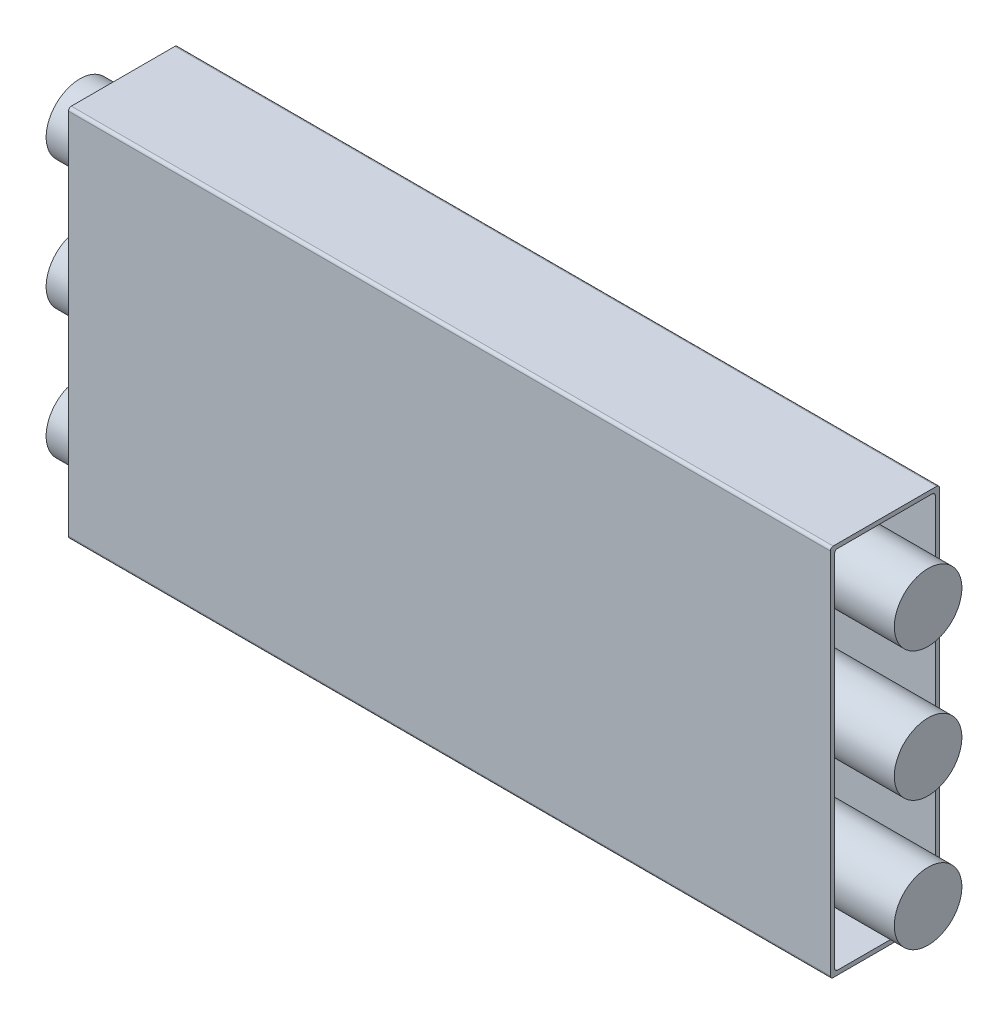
SolidWorks part; units mm, degrees
ref_plane "XY" through (0, 0, 0) normal (0, 0, 1) x (1, 0, 0)
ref_plane "XZ" through (0, 0, 0) normal (0, 1, 0) x (1, 0, 0)
ref_plane "YZ" through (0, 0, 0) normal (1, 0, 0) x (0, 0, -1)
sketch "Esquisse1" plane through (0, 0, 0) normal (0, 0, 1) x (1, 0, 0)
  line L1 (-16.5, -13) -> (16.5, -13)
  line L2 (-16.5, -13) -> (-16.5, 13)
  line L3 (-16.5, 13) -> (16.5, 13)
  line L4 (16.5, -13) -> (16.5, 13)
  line L5 (-16.5, -13) -> (16.5, 13) construction
  line L6 (-16.5, 13) -> (16.5, -13) construction
  point P0 (0, 0)
  dimension "D1" = 26
  dimension "D2" = 33
extrude "brut" add sketch "Esquisse1" along normal blind 7.6
sketch "Esquisse3" plane through (16.5, 0, 0) normal (1, 0, 0) x (0, 0, -1)
  line L1 (-7.6, 13) -> (0, 13)
  line L2 (-7.6, 13) -> (-7.6, -13)
  line L3 (-7.6, -13) -> (0, -13)
  line L4 (0, 13) -> (0, -13)
  line L5 (-7.3, 12.7) -> (-0.3, 12.7)
  line L6 (-7.3, 12.7) -> (-7.3, -12.7)
  line L7 (-7.3, -12.7) -> (-0.3, -12.7)
  line L8 (-0.3, 12.7) -> (-0.3, -12.7)
  dimension "D1" = 0.3
  dimension "D2" = 0.3
  dimension "D3" = 0.3
  dimension "D4" = 0.3
extrude "rajout" add sketch "Esquisse3" along normal blind 10
sketch "Esquisse4" plane through (16.5, 0, 0) normal (1, 0, 0) x (0, 0, -1)
  line L0 (-3.8, 12.7) -> (-3.8, -12.7) construction
  line L1 (-0.3, 12.7) -> (-7.3, 12.7) construction
  line L2 (-7.3, -12.7) -> (-0.3, -12.7) construction
  circle A0 centre (-3.8, 9) radius 2.35
  circle A1 centre (-3.8, 0) radius 2.35
  circle A2 centre (-3.8, -9) radius 2.35
  dimension "D1" = 4.7
  dimension "D2" = 9
  dimension "D3" = 9
extrude "fils" add sketch "Esquisse4" along normal blind 13
mirror "repet' fils" about plane through (0, 0, 0) normal (1, 0, 0) of "rajout", "fils"
fillet "Congé1" radius 0.2 12 edges at (-21.5, 12.7, 0.3) (21.5, -12.7, 0.3) (21.5, 12.7, 0.3) (21.5, 12.7, 7.3) (21.5, -12.7, 7.3) (-21.5, 12.7, 7.3) (-21.5, -12.7, 7.3) (-21.5, -12.7, 0.3) (0, -13, 0) (0, -13, 7.6) (0, 13, 0) (0, 13, 7.6)
